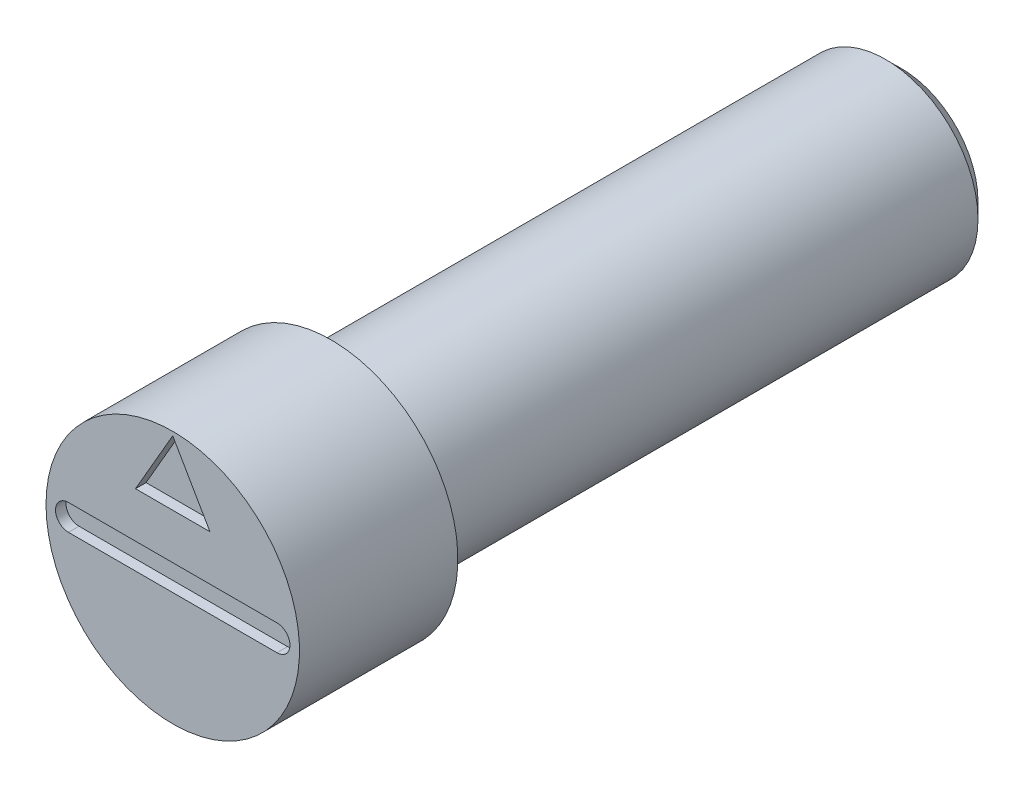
SolidWorks part; units mm, degrees
ref_plane "Front Plane" through (0, 0, 0) normal (0, 0, 1) x (1, 0, 0)
ref_plane "Top Plane" through (0, 0, 0) normal (0, 1, 0) x (1, 0, 0)
ref_plane "Right Plane" through (0, 0, 0) normal (1, 0, 0) x (0, 0, -1)
imported_body "Imported1"
other "DeleteFace1"
sketch "Sketch1" plane through (0, 0, 0) normal (0, 0, 1) x (1, 0, 0)
  line L0 (0, 2.3261) -> (-0.705, 1.105)
  line L1 (-0.705, 1.105) -> (0.705, 1.105)
  line L2 (0.705, 1.105) -> (0, 2.3261)
  line L4 (-1.975, 0.245) -> (1.975, 0.245)
  line L6 (-1.975, -0.245) -> (1.975, -0.245)
  arc A0 (-1.975, 0.245) -> (-1.975, -0.245) centre (-1.975, 0) ccw
  arc A1 (1.975, -0.245) -> (1.975, 0.245) centre (1.975, 0) ccw
  dimension "D2" = 4.44
  dimension "D3" = 2.22
  dimension "D1" = 0.49
  dimension "D4" = 1.41
  dimension "D5" = 60
  dimension "D6" = 60
  dimension "D7" = 0.86
  dimension "D8" = 0.245
extrude "Cut-Extrude1" cut sketch "Sketch1" against normal blind 0.2
sketch "Sketch2" plane through (0, 0, -18) normal (0, 0, -1) x (-1, 0, 0)
  circle A1 centre (0, 0) radius 1.75
  circle A2 centre (0, 0) radius 1.75
  dimension "D1" = 0
extrude "Cut-Extrude2" cut sketch "Sketch2" against normal offset from surface (4.2 mm away) 13.8
chamfer "Chamfer1" distance 0.3 angle 45 1 edges at (1.75, 0, -13.8)
